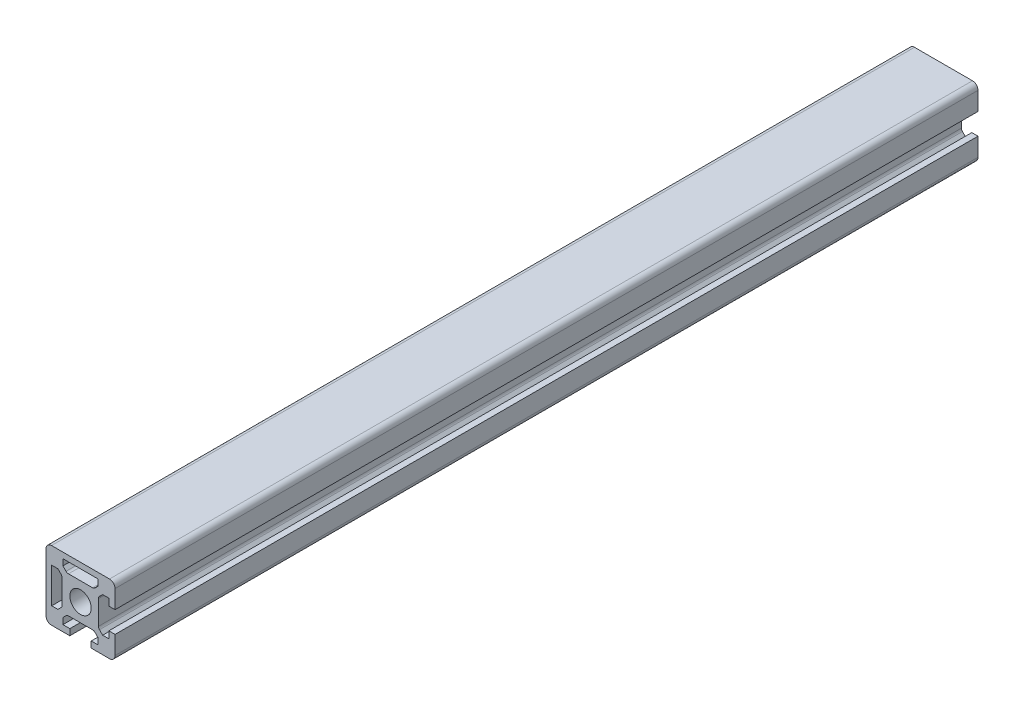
SolidWorks part; units mm, degrees
ref_plane "Front" through (0, 0, 0) normal (0, 0, 1) x (1, 0, 0)
ref_plane "Top" through (0, 0, 0) normal (0, 1, 0) x (1, 0, 0)
ref_plane "Right" through (0, 0, 0) normal (1, 0, 0) x (0, 0, -1)
ref_plane "Plan1" through (0, 0, 1) normal (0, 0, 1) x (1, 0, 0)
sketch "Esquisse1" plane through (0, 0, 1) normal (0, 0, 1) x (1, 0, 0)
  line L0 (3.4858, 5.35) -> (-3.4858, 5.35)
  line L1 (-4.1929, 5.6429) -> (-5.1, 6.55)
  line L2 (-5.1, 6.55) -> (-5.1, 8.35)
  line L3 (-5.1, 8.35) -> (5.1, 8.35)
  line L4 (5.1, 8.35) -> (5.1, 6.55)
  line L5 (5.1, 6.55) -> (4.1929, 5.6429)
  line L6 (-10, 8.4) -> (-10, -8.4)
  line L7 (-8.4, -10) -> (-3.1, -10)
  line L8 (-3.1, -10) -> (-3.1, -8.2)
  line L9 (-3.1, -8.2) -> (-5.1, -8.2)
  line L10 (-5.1, -8.2) -> (-5.1, -6.4)
  line L11 (-5.1, -6.4) -> (-4.1929, -5.4929)
  line L12 (-3.4858, -5.2) -> (3.4858, -5.2)
  line L13 (4.1929, -5.4929) -> (5.1, -6.4)
  line L14 (5.1, -6.4) -> (5.1, -8.2)
  line L15 (5.1, -8.2) -> (3.1, -8.2)
  line L16 (3.1, -8.2) -> (3.1, -10)
  line L17 (3.1, -10) -> (8.4, -10)
  line L18 (10, -8.4) -> (10, -3.1)
  line L19 (10, -3.1) -> (8.2, -3.1)
  line L20 (8.2, -3.1) -> (8.2, -5.1)
  line L21 (8.2, -5.1) -> (6.4, -5.1)
  line L22 (6.4, -5.1) -> (5.4929, -4.1929)
  line L23 (5.2, -3.4858) -> (5.2, 3.4858)
  line L24 (5.4929, 4.1929) -> (6.4, 5.1)
  line L25 (6.4, 5.1) -> (8.2, 5.1)
  line L26 (8.2, 5.1) -> (8.2, 3.1)
  line L27 (8.2, 3.1) -> (10, 3.1)
  line L28 (10, 3.1) -> (10, 8.4)
  line L29 (8.4, 10) -> (-8.4, 10)
  line L30 (-5.35, 3.4858) -> (-5.35, -3.4858)
  line L31 (-5.6429, -4.1929) -> (-6.55, -5.1)
  line L32 (-6.55, -5.1) -> (-8.35, -5.1)
  line L33 (-8.35, -5.1) -> (-8.35, 5.1)
  line L34 (-8.35, 5.1) -> (-6.55, 5.1)
  line L35 (-6.55, 5.1) -> (-5.6429, 4.1929)
  circle A0 centre (0, 0) radius 3.1
  arc A1 (-3.4858, 5.35) -> (-4.1929, 5.6429) centre (-3.4858, 6.35) cw
  arc A2 (4.1929, 5.6429) -> (3.4858, 5.35) centre (3.4858, 6.35) cw
  arc A3 (-8.4, 10) -> (-10, 8.4) centre (-8.4, 8.4) ccw
  arc A4 (-10, -8.4) -> (-8.4, -10) centre (-8.4, -8.4) ccw
  arc A5 (-4.1929, -5.4929) -> (-3.4858, -5.2) centre (-3.4858, -6.2) cw
  arc A6 (3.4858, -5.2) -> (4.1929, -5.4929) centre (3.4858, -6.2) cw
  arc A7 (8.4, -10) -> (10, -8.4) centre (8.4, -8.4) ccw
  arc A8 (5.4929, -4.1929) -> (5.2, -3.4858) centre (6.2, -3.4858) cw
  arc A9 (5.2, 3.4858) -> (5.4929, 4.1929) centre (6.2, 3.4858) cw
  arc A10 (10, 8.4) -> (8.4, 10) centre (8.4, 8.4) ccw
  arc A11 (-5.35, -3.4858) -> (-5.6429, -4.1929) centre (-6.35, -3.4858) cw
  arc A12 (-5.6429, 4.1929) -> (-5.35, 3.4858) centre (-6.35, 3.4858) cw
extrude "Boss.-Extru.1" add sketch "Esquisse1" against normal blind 250
